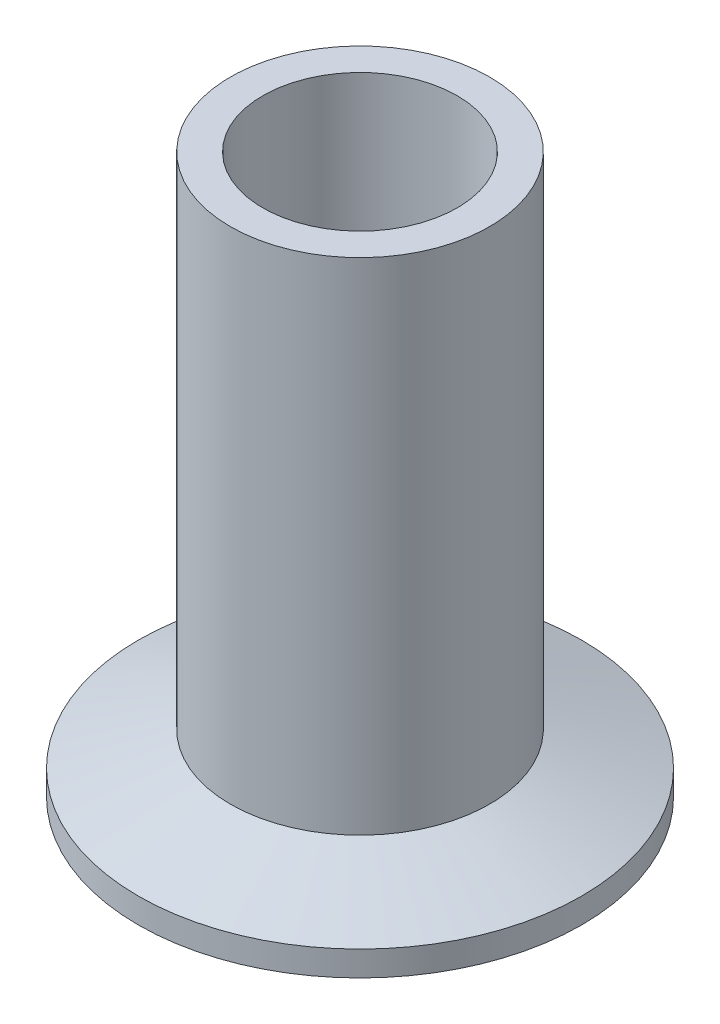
SolidWorks part; units mm, degrees
ref_plane "Front Plane" through (0, 0, 0) normal (0, 0, 1) x (1, 0, 0)
ref_plane "Top Plane" through (0, 0, 0) normal (0, 1, 0) x (1, 0, 0)
ref_plane "Right Plane" through (0, 0, 0) normal (1, 0, 0) x (0, 0, -1)
sketch "Sketch1" plane through (0, 0, 0) normal (0, 0, 1) x (1, 0, 0)
  line L0 (0, 0) -> (0, 63.5) construction
  line L1 (0, 63.5) -> (-14.732, 63.5)
  line L2 (-14.732, 63.5) -> (-14.732, 6.6537)
  line L3 (-14.732, 6.6537) -> (-25.1968, 2.8448)
  line L4 (-25.1968, 2.8448) -> (-25.1968, 0)
  line L5 (-25.1968, 0) -> (-23.6441, 0)
  line L6 (-20.0446, 0) -> (0, 0)
  line L7 (0, 0) -> (0, 63.5)
  line L8 (0, 63.5) -> (-11.049, 63.5)
  line L9 (-11.049, 63.5) -> (-11.049, 0)
  line L10 (-11.049, 0) -> (0, 0)
  line L11 (0, 0) -> (-0.1846, 0.0129)
  line L12 (-14.732, 6.6537) -> (-17.7525, 6.6537) construction
  line L13 (-20.5219, 0.3343) -> (-20.6968, 0.8147)
  line L14 (-22.9634, 0.7448) -> (-23.1876, 0.2853)
  line L15 (-21.8186, 0.4064) -> (-21.8186, -0.8532) construction
  arc A0 (-20.6968, 0.8147) -> (-22.9634, 0.7448) centre (-21.8186, 0.4064) ccw
  arc A1 (-20.0446, 0) -> (-20.5219, 0.3343) centre (-20.0446, 0.508) cw
  arc A2 (-23.6441, 0) -> (-23.1876, 0.2853) centre (-23.6441, 0.508) ccw
  dimension "D6" = 0.4064
  dimension "D7" = 21.8186
  dimension "D5" = 46
  dimension "D10" = 1.1938
  dimension "D11" = 0.508
  dimension "D1" = 14.732
  dimension "D2" = 20
  dimension "D3" = 25.1968
  dimension "D4" = 2.8448
  dimension "D8" = 3.683
  dimension "D9" = 63.5
revolve "Revolve2" add sketch "Sketch1" angle 360 about L0
